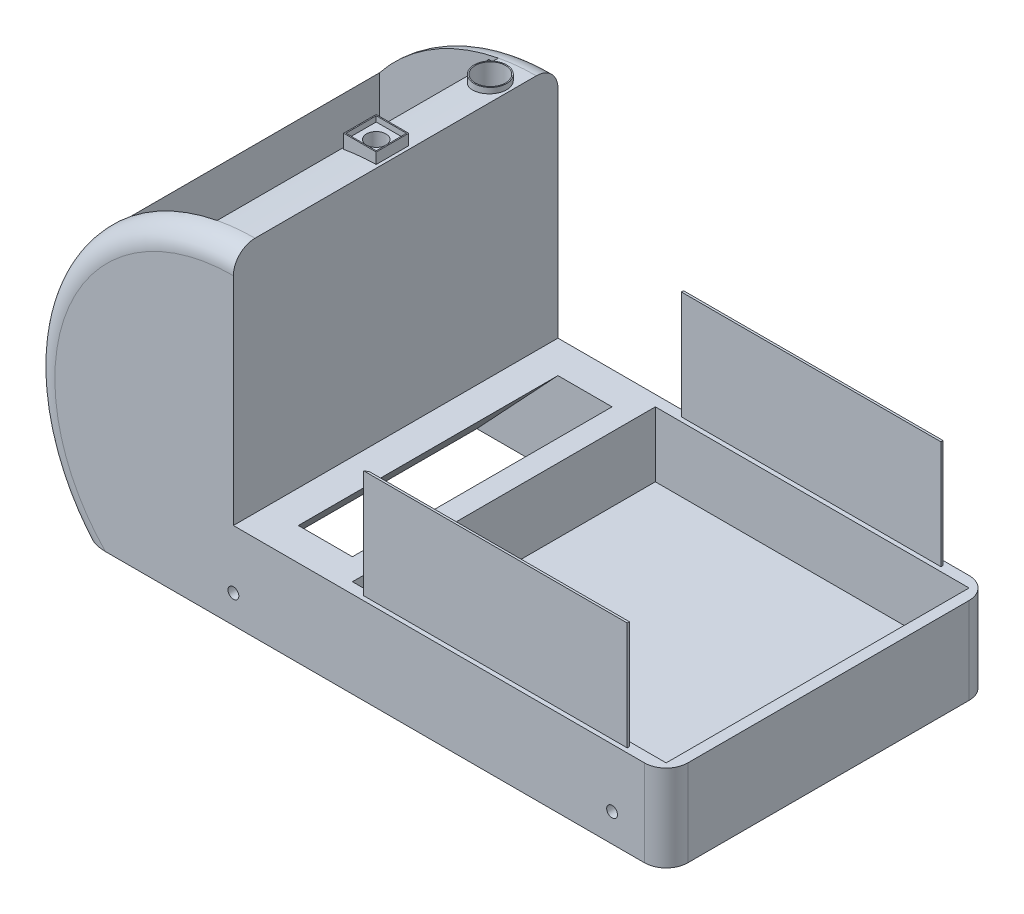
SolidWorks part; units mm, degrees
ref_plane "Front Plane" through (0, 0, 0) normal (0, 0, 1) x (1, 0, 0)
ref_plane "Top Plane" through (0, 0, 0) normal (0, 1, 0) x (1, 0, 0)
ref_plane "Right Plane" through (0, 0, 0) normal (1, 0, 0) x (0, 0, -1)
sketch "Sketch1" plane through (0, 0, 0) normal (0, 0, 1) x (1, 0, 0)
  line L1 (500, 0) -> (500, 80)
  line L2 (500, 80) -> (100, 80)
  line L3 (100, 80) -> (100, 300)
  line L7 (500, 0) -> (-44.9138, 0)
  arc A1 (100, 300) -> (-44.9138, 0) centre (100, 115) ccw
  dimension "D2" = 35
  dimension "D6" = 185
  dimension "D1" = 400
  dimension "D3" = 220
  dimension "D4" = 500
  dimension "D5" = 80
extrude "Boss-Extrude1" add sketch "Sketch1" along normal blind 300
sketch "Sketch2" plane through (0, 80, 0) normal (0, 1, 0) x (1, 0, 0)
  line L0 (500, -300) -> (500, -290) construction
  line L1 (500, -300) -> (500, 0) construction
  line L2 (500, -290) -> (490, -290) construction
  line L3 (500, 0) -> (100, 0) construction
  line L4 (490, -290) -> (200, -290)
  line L5 (490, -290) -> (490, -10)
  line L6 (490, -10) -> (200, -10)
  line L7 (200, -290) -> (200, -10)
  dimension "D1" = 10
  dimension "D2" = 10
  dimension "D3" = 10
  dimension "D4" = 300
extrude "Cut-Extrude1" cut sketch "Sketch2" against normal blind 60
sketch "Sketch4" plane through (0, 80, 0) normal (0, 1, 0) x (1, 0, 0)
  line L0 (200, -10) -> (180, -10) construction
  line L1 (180, -10) -> (180, -30) construction
  line L2 (500, 0) -> (100, 0) construction
  line L3 (180, -30) -> (130, -30)
  line L4 (180, -30) -> (180, -270)
  line L5 (180, -270) -> (130, -270)
  line L6 (130, -30) -> (130, -270)
  line L7 (500, -300) -> (100, -300) construction
  line L8 (200, -10) -> (200, -290) construction
  dimension "D1" = 30
  dimension "D2" = 30
  dimension "D3" = 20
  dimension "D4" = 50
fillet "Fillet1" radius 20 2 edges at (500, 40, 0) (500, 40, 300)
sketch "Sketch8" plane through (0, 80, 0) normal (0, 1, 0) x (1, 0, 0)
  line L0 (490, -290) -> (460, -290) construction
  line L1 (200, -290) -> (490, -290) construction
  line L2 (460, -290) -> (460, -294) construction
  line L3 (460, -294) -> (220, -294)
  line L4 (220, -294) -> (216.3589, -296)
  line L5 (216.3589, -296) -> (460, -296)
  line L6 (460, -296) -> (460, -294)
  line L7 (200, -290) -> (490, -290) construction
  line L8 (490, -290) -> (490, -10) construction
  line L9 (460, -294) -> (460, -6) construction
  line L11 (460, -6) -> (220, -6)
  line L12 (460, -6) -> (460, -4)
  line L13 (460, -4) -> (220, -4)
  line L14 (220, -6) -> (220, -4)
  line L17 (490, -10) -> (200, -10) construction
  line L19 (200, -10) -> (200, -290) construction
  line L21 (480, 0) -> (100, 0) construction
  dimension "D1" = 2
  dimension "D2" = 240
  dimension "D3" = 4
  dimension "D4" = 30
  dimension "D5" = 4
  dimension "D6" = 2
  dimension "D7" = 240
  dimension "D8" = 16.3589
extrude "Boss-Extrude2" add sketch "Sketch8" along normal blind 100
sketch "Sketch9" plane through (0, 0, 300) normal (0, 0, 1) x (1, 0, 0)
  line L0 (480, 26) -> (450, 26) construction
  line L1 (480, 0) -> (480, 80) construction
  line L3 (-44.9138, 0) -> (480, 0) construction
  circle A0 centre (450, 26) radius 5
  dimension "D1" = 10
  dimension "D2" = 30
  dimension "D3" = 26
extrude "Cut-Extrude4" cut sketch "Sketch9" against normal blind 350
sketch "Sketch10" plane through (0, 0, 300) normal (0, 0, 1) x (1, 0, 0)
  line L0 (450, 26) -> (100, 26) construction
  line L1 (-44.9138, 0) -> (480, 0) construction
  circle A0 centre (100, 26) radius 5
  dimension "D1" = 10
  dimension "D3" = 26
  dimension "D2" = 350
extrude "Cut-Extrude5" cut sketch "Sketch10" against normal blind 10
sketch "Sketch11" plane through (0, 20, 0) normal (0, 1, 0) x (1, 0, 0)
  line L0 (200, -150) -> (500, -150) construction
  line L1 (200, -10) -> (200, -290) construction
  line L2 (500, -280) -> (500, -20) construction
ref_plane "Plane1" through (0, 0, 150) normal (0, 0, 1) x (1, 0, 0)
sketch "Sketch12" plane through (0, 0, 0) normal (0, -1, 0) x (1, 0, 0)
  line L0 (130, 270) -> (105, 270) construction
  line L2 (105, 270) -> (55, 270)
  line L3 (105, 270) -> (105, 30)
  line L4 (105, 30) -> (55, 30)
  line L5 (55, 270) -> (55, 30)
  dimension "D1" = 50
  dimension "D2" = 240
  dimension "D3" = 25
loft "Cut-Loft1" cut profiles "Sketch12", "Sketch4"
sketch "Sketch13" plane through (0, 0, 0) normal (0, 0, -1) x (-1, 0, 0)
  line L0 (-445, 26) -> (-95, 26) construction
  circle A0 centre (-450, 26) radius 5 construction
  circle A1 centre (-95, 26) radius 5
  dimension "D2" = 10
  dimension "D1" = 350
extrude "Cut-Extrude6" cut sketch "Sketch13" against normal blind 10
ref_plane "Plane2" through (0, 300, 0) normal (0, -1, 0) x (0, 0, -1)
sketch "Sketch14" plane through (0, 300, 0) normal (0, -1, 0) x (0, 0, -1)
  line L0 (0, 100) -> (-20, 100) construction
  line L1 (-300, 100) -> (0, 100) construction
  line L2 (-20, 100) -> (-20, 65) construction
  line L3 (0, -85) -> (0, 100) construction
  line L4 (-20, 65) -> (-280, 65)
  line L5 (-20, 65) -> (-20, -45)
  line L6 (-20, -45) -> (-280, -45)
  line L7 (-280, 65) -> (-280, -45)
  dimension "D1" = 110
  dimension "D2" = 260
  dimension "D3" = 20
  dimension "D4" = 35
extrude "Cut-Extrude7" cut sketch "Sketch14" along normal blind 250
sketch "Sketch15" plane through (0, 0, 20) normal (0, 0, 1) x (1, 0, 0)
  line L0 (65, 296.659) -> (65, 288.659) construction
  line L1 (65, 50) -> (65, 296.659) construction
  line L2 (65, 288.659) -> (57, 288.659) construction
  circle A0 centre (57, 288.659) radius 2.5
  dimension "D1" = 5
  dimension "D2" = 8
  dimension "D3" = 8
extrude "Cut-Extrude8" cut sketch "Sketch15" against normal blind 5
sketch "Sketch17" plane through (0, 0, 0) normal (0, -1, 0) x (1, 0, 0)
  line L0 (-44.9138, 0) -> (-44.9138, 50) construction
  line L1 (-44.9138, 300) -> (-44.9138, 0) construction
  line L2 (-44.9138, 50) -> (-4.9138, 50) construction
  line L3 (-4.9138, 50) -> (-4.9138, 250) construction
  line L4 (100, 300) -> (-85, 300) construction
  circle A0 centre (-4.9138, 50) radius 15
  circle A2 centre (-4.9138, 250) radius 15
  dimension "D3" = 30
  dimension "D4" = 50
  dimension "D5" = 30
  dimension "D1" = 50
  dimension "D2" = 40
extrude "Cut-Extrude10" cut sketch "Sketch17" against normal through all
fillet "Fillet2" radius 20 2 edges at (-66.5833, 195.4674, 300) (-66.5833, 195.4674, 0)
sketch "Sketch18" plane through (0, 0, 280) normal (0, 0, -1) x (-1, 0, 0)
  line L0 (-65, 296.659) -> (-65, 288.659) construction
  line L1 (-65, 50) -> (-65, 296.659) construction
  line L2 (-65, 288.659) -> (-57, 288.659) construction
  circle A0 centre (-57, 288.659) radius 2.5
  dimension "D3" = 5
  dimension "D1" = 8
  dimension "D2" = 8
extrude "Cut-Extrude11" cut sketch "Sketch18" against normal blind 5
ref_plane "Plane3" through (0, 5, 0) normal (0, -1, 0) x (-1, 0, 0)
ref_plane "Plane4" through (0, 45, 0) normal (0, 1, 0) x (1, 0, 0)
sketch "Sketch21" plane through (0, 50, 0) normal (0, 1, 0) x (1, 0, 0)
  line L0 (-45, -20) -> (-45, -29.24) construction
  line L1 (-45, -280) -> (-45, -20) construction
  line L2 (-45, -29.24) -> (-20.67, -29.24) construction
  line L3 (-20.67, -29.24) -> (10.84, -29.24) construction
  line L4 (10.84, -29.24) -> (10.84, -70.75) construction
  line L5 (10.84, -70.75) -> (-20.67, -70.75) construction
  line L6 (-20.67, -70.75) -> (-20.67, -29.24) construction
  line L7 (-45, -20) -> (65, -20) construction
  line L9 (-20.67, -229.25) -> (10.84, -229.25) construction
  line L10 (10.84, -229.25) -> (10.84, -270.76) construction
  line L11 (10.84, -270.76) -> (-20.67, -270.76) construction
  line L12 (-20.67, -270.76) -> (-20.67, -229.25) construction
  line L13 (65, -280) -> (-45, -280) construction
  dimension "D1" = 24.33
  dimension "D2" = 9.24
  dimension "D3" = 41.51
  dimension "D4" = 31.51
  dimension "D5" = 9.24
  dimension "D6" = 24.33
  dimension "D7" = 31.51
  dimension "D8" = 41.51
hole_wizard "M3 Clearance Hole1" positions "3DSketch1" profile "Sketch22" hole size "M3" standard "ISO"
sketch3d "3DSketch1"
  point P0 (10.84, 50, 29.24)
  point P3 (10.84, 50, 70.75)
  point P6 (-20.67, 50, 70.75)
  point P9 (-20.67, 50, 29.24)
  point P13 (10.84, 50, 229.25)
  point P16 (10.84, 50, 270.76)
  point P19 (-20.67, 50, 270.76)
  point P22 (-20.67, 50, 229.25)
sketch "Sketch22" plane through (10.84, 50, 29.24) normal (1, 0, 0) x (0, 0, 1)
  line L0 (0, 0) -> (0, 9.0215)
  line L1 (0, 9.0215) -> (1.7, 8)
  line L2 (1.7, 8) -> (1.7, 0)
  line L5 (1.7, 0) -> (0, 0)
  line L10 (0, 9.0215) -> (-1.7, 8) construction
  line L11 (0, -6.35) -> (0, 107.95) construction
  dimension "Hole Dia." = 3.4
  dimension "Hole Depth" = 8
  dimension "Drill Angle" = 118
ref_plane "Plane7" through (0, 300, 0) normal (0, 1, 0) x (1, 0, 0)
sketch "Sketch28" plane through (0, 300, 0) normal (0, 1, 0) x (1, 0, 0)
  line L0 (100, -280) -> (97, -280) construction
  line L1 (65, -280) -> (100, -280) construction
  line L2 (97, -280) -> (97, -165) construction
  line L4 (97, -165) -> (67, -165)
  line L5 (97, -165) -> (97, -135)
  line L6 (97, -135) -> (67, -135)
  line L7 (67, -165) -> (67, -135)
  dimension "D1" = 30
  dimension "D2" = 30
  dimension "D3" = 3
  dimension "D4" = 115
extrude "Boss-Extrude3" add sketch "Sketch28" along normal mid plane 20
sketch "Sketch29" plane through (0, 310, 0) normal (0, 1, 0) x (1, 0, 0)
  line L0 (67, -135) -> (67, -136) construction
  line L1 (67, -135) -> (67, -165) construction
  line L2 (67, -136) -> (68, -136) construction
  line L3 (97, -165) -> (97, -135) construction
  line L4 (68, -136) -> (96, -136)
  line L5 (68, -136) -> (68, -164)
  line L6 (68, -164) -> (96, -164)
  line L7 (96, -136) -> (96, -164)
  line L8 (97, -135) -> (67, -135) construction
  line L9 (67, -165) -> (97, -165) construction
  dimension "D1" = 1
  dimension "D2" = 1
  dimension "D3" = 1
  dimension "D4" = 1
extrude "Cut-Extrude16" cut sketch "Sketch29" against normal blind 5
sketch "Sketch30" plane through (0, 305, 0) normal (0, 1, 0) x (1, 0, 0)
  line L0 (82, -136) -> (82, -164) construction
  line L1 (96, -136) -> (68, -136) construction
  line L2 (68, -164) -> (96, -164) construction
  circle A0 centre (82, -150) radius 9
  dimension "D1" = 18
extrude "Cut-Extrude17" cut sketch "Sketch30" against normal blind 30
sketch "Sketch31" plane through (0, 300, 0) normal (0, 1, 0) x (1, 0, 0)
  line L0 (82.5, -20) -> (82.5, -45) construction
  line L1 (100, -20) -> (65, -20) construction
  circle A0 centre (82.5, -45) radius 15
  dimension "D2" = 30
  dimension "D1" = 25
extrude "Boss-Extrude4" add sketch "Sketch31" along normal mid plane 10
sketch "Sketch32" plane through (0, 305, 0) normal (0, 1, 0) x (1, 0, 0)
  circle A0 centre (82.5, -45) radius 14
  dimension "D1" = 28
extrude "Cut-Extrude18" cut sketch "Sketch32" against normal blind 34
